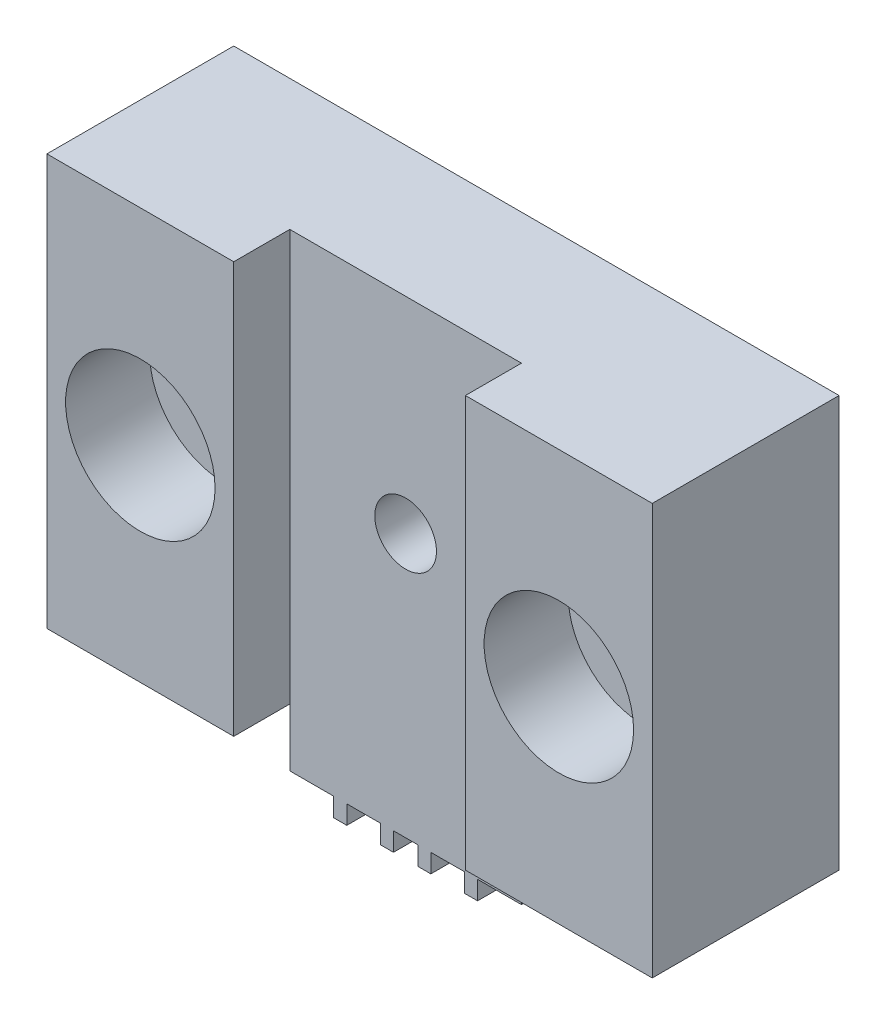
SolidWorks part; units mm, degrees
ref_plane "前视基准面" through (0, 0, 0) normal (0, 0, 1) x (1, 0, 0)
ref_plane "上视基准面" through (0, 0, 0) normal (0, 1, 0) x (1, 0, 0)
ref_plane "右视基准面" through (0, 0, 0) normal (1, 0, 0) x (0, 0, -1)
sketch "草图1" plane through (0, 0, 0) normal (0, 0, 1) x (1, 0, 0)
  line L0 (10, 1) -> (10, 4.1)
  line L1 (22.4, 1) -> (22.4, 4.1)
  line L2 (12.35, 0) -> (13.05, 0)
  line L3 (0, 26.1) -> (32.4, 26.1)
  line L4 (0, 4.1) -> (0, 26.1)
  line L5 (32.4, 4.1) -> (32.4, 26.1)
  line L6 (10, 1) -> (12.35, 1)
  line L7 (0, 4.1) -> (10, 4.1)
  line L8 (22.4, 4.1) -> (32.4, 4.1)
  line L9 (12.35, 0) -> (12.35, 1)
  line L10 (13.05, 0) -> (13.05, 1)
  line L11 (14.85, 0) -> (14.85, 1)
  line L12 (15.55, 0) -> (15.55, 1)
  line L13 (16.85, 0) -> (16.85, 1)
  line L14 (17.55, 0) -> (17.55, 1)
  line L15 (19.35, 0) -> (19.35, 1)
  line L16 (20.05, 0) -> (20.05, 1)
  line L17 (19.35, 0) -> (20.05, 0)
  line L18 (16.85, 0) -> (17.55, 0)
  line L19 (14.85, 0) -> (15.55, 0)
  line L20 (13.05, 1) -> (14.85, 1)
  line L21 (15.55, 1) -> (16.85, 1)
  line L22 (17.55, 1) -> (19.35, 1)
  line L23 (20.05, 1) -> (22.4, 1)
extrude "凸台-拉伸1" add sketch "草图1" along normal blind 10
sketch "草图2" plane through (0, 0, 10) normal (0, 0, 1) x (1, 0, 0)
  circle A0 centre (16.2, 15.1) radius 1.65
  circle A1 centre (27.4, 15.1) radius 2.25
  circle A2 centre (5, 15.1) radius 2.25
extrude "切除-拉伸1" cut sketch "草图2" against normal blind 10
sketch "草图3" plane through (0, 0, 10) normal (0, 0, 1) x (1, 0, 0)
  circle A0 centre (27.4, 15.1) radius 4
  circle A1 centre (5, 15.1) radius 4
extrude "切除-拉伸2" cut sketch "草图3" against normal blind 4.5
sketch "草图4" plane through (32.4, 0, 0) normal (1, 0, 0) x (0, 0, -1)
  line L0 (-7, 0) -> (-3.5, 0)
  line L1 (-10, 4.1) -> (-7, 4.1)
  line L2 (-10, 26.1) -> (0, 26.1)
  line L3 (-7, 0) -> (-7, 4.1)
  line L4 (0, 4.1) -> (0, 26.1)
  line L5 (-3.5, 0) -> (-3.5, 4.1)
  line L6 (-10, 4.1) -> (-10, 26.1)
  line L7 (-3.5, 4.1) -> (0, 4.1)
extrude "切除-拉伸3" cut sketch "草图4" against normal through all flip side to cut
sketch "草图5" plane through (0, 26.1, 0) normal (0, 1, 0) x (1, 0, 0)
  line L0 (10, -10) -> (10, -7)
  line L1 (22.4, -10) -> (22.4, -7)
  line L2 (32.4, -10) -> (32.4, 0)
  line L3 (0, -10) -> (0, 0)
  line L4 (0, -10) -> (10, -10)
  line L5 (10, -7) -> (22.4, -7)
  line L6 (0, 0) -> (32.4, 0)
  line L7 (22.4, -10) -> (32.4, -10)
extrude "切除-拉伸4" cut sketch "草图5" against normal through all flip side to cut
